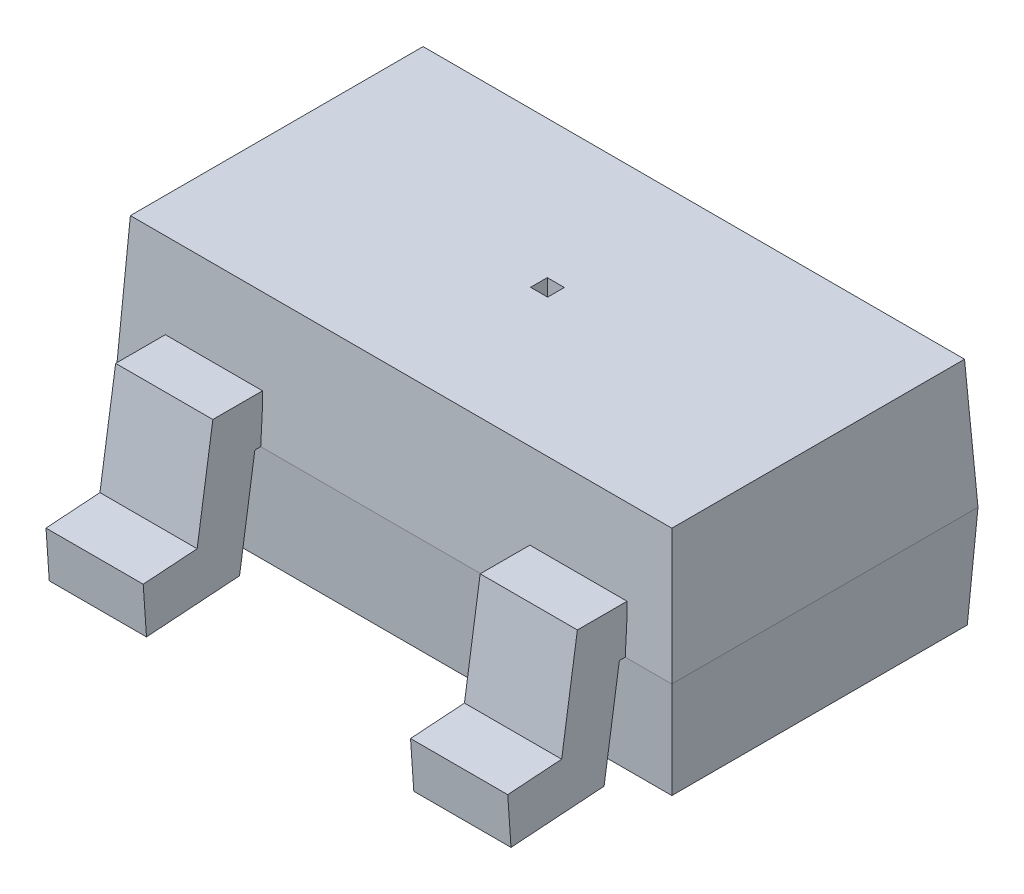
SolidWorks part; units mm, degrees
ref_plane "Front" through (0, 0, 0) normal (0, 0, 1) x (1, 0, 0)
ref_plane "Top" through (0, 0, 0) normal (0, 1, 0) x (1, 0, 0)
ref_plane "Right" through (0, 0, 0) normal (1, 0, 0) x (0, 0, -1)
sketch "Sketch1" plane through (0, 0, 0) normal (0, 1, 0) x (1, 0, 0)
  line L0 (1.45, -0.8) -> (-1.45, 0.8) construction
  line L1 (-1.45, 0.8) -> (1.45, 0.8)
  line L2 (-1.45, 0.8) -> (-1.45, -0.8)
  line L3 (-1.45, -0.8) -> (1.45, -0.8)
  line L4 (1.45, 0.8) -> (1.45, -0.8)
  dimension "D1" = 2.9
  dimension "D2" = 1.6
extrude "Boss-Extrude1" add sketch "Sketch1" against normal blind 0.533 draft 3
sketch "Sketch5" plane through (0, 0, 0) normal (0, 1, 0) x (1, 0, 0)
  line L4 (-1.45, 0.8) -> (-1.45, -0.8)
  line L5 (-1.45, -0.8) -> (1.45, -0.8)
  line L6 (1.45, -0.8) -> (1.45, 0.8)
  line L7 (1.45, 0.8) -> (-1.45, 0.8)
  line L8 (-1.45, 0.8) -> (-1.45, -0.8)
  line L9 (-1.45, -0.8) -> (1.45, -0.8)
  line L10 (1.45, -0.8) -> (1.45, 0.8)
  line L11 (1.45, 0.8) -> (-1.45, 0.8)
  dimension "D1" = 0
extrude "Boss-Extrude4" add sketch "Sketch5" along normal blind 0.67 draft 3
sketch "Sketch6" plane through (0, 0, 0) normal (1, 0, 0) x (0, 0, -1)
  line L0 (0.7905, 0) -> (0.8307, 0)
  line L1 (0.8307, 0) -> (0.9106, -0.5292)
  line L2 (0.9106, -0.5292) -> (1.397, -0.5629)
  line L3 (0.7905, 0.248) -> (1.0502, 0.248)
  line L4 (1.0502, 0.248) -> (1.1323, -0.2959)
  line L5 (1.1323, -0.2959) -> (1.4141, -0.3154)
  line L6 (1.4141, -0.3154) -> (1.397, -0.5629)
  line L7 (0.7905, 0.248) -> (0.7905, 0)
  line L8 (0, 0) -> (0, 0.4994) construction
  line L9 (-0.7905, 0.248) -> (-0.7905, 0) construction
  line L10 (-1.4141, -0.3154) -> (-1.397, -0.5629) construction
  line L11 (-1.1323, -0.2959) -> (-1.4141, -0.3154) construction
  line L12 (-1.0502, 0.248) -> (-1.1323, -0.2959) construction
  line L13 (-0.7905, 0.248) -> (-1.0502, 0.248) construction
  line L14 (-0.9106, -0.5292) -> (-1.397, -0.5629) construction
  line L15 (-0.8307, 0) -> (-0.9106, -0.5292) construction
  line L16 (-0.7905, 0) -> (-0.8307, 0) construction
  dimension "D1" = 0.248
  dimension "D2" = 0.248
  dimension "D3" = 1.397
  dimension "D4" = 0.254
extrude "Boss-Extrude5" add sketch "Sketch6" along normal mid plane 0.508
sketch "Sketch7" plane through (0, 0, 0) normal (1, 0, 0) x (0, 0, -1)
  line L0 (-0.7905, 0.248) -> (-0.7905, 0) construction
  line L1 (-0.7905, 0.248) -> (-1.0502, 0.248) construction
  line L2 (-1.0502, 0.248) -> (-1.1323, -0.2959) construction
  line L3 (-0.7905, 0) -> (-0.8307, 0) construction
  line L4 (-0.8307, 0) -> (-0.9106, -0.5292) construction
  line L5 (-0.9106, -0.5292) -> (-1.397, -0.5629) construction
  line L6 (-1.4141, -0.3154) -> (-1.397, -0.5629) construction
  line L7 (-1.1323, -0.2959) -> (-1.4141, -0.3154) construction
  line L8 (-0.7905, 0.248) -> (-0.7905, 0)
  line L9 (-0.7905, 0.248) -> (-1.0502, 0.248)
  line L10 (-1.0502, 0.248) -> (-1.1323, -0.2959)
  line L11 (-0.7905, 0) -> (-0.8307, 0)
  line L12 (-0.8307, 0) -> (-0.9106, -0.5292)
  line L13 (-0.9106, -0.5292) -> (-1.397, -0.5629)
  line L14 (-1.4141, -0.3154) -> (-1.397, -0.5629)
  line L15 (-1.1323, -0.2959) -> (-1.4141, -0.3154)
extrude "Boss-Extrude6" add sketch "Sketch7" along normal blind 0.508 from offset 0.6985
sketch "Sketch8" plane through (0, 0, 0) normal (1, 0, 0) x (0, 0, -1)
  line L0 (-0.7905, 0) -> (-0.8307, 0) construction
  line L1 (-0.7905, 0.248) -> (-0.7905, 0) construction
  line L2 (-0.7905, 0.248) -> (-1.0502, 0.248) construction
  line L3 (-1.0502, 0.248) -> (-1.1323, -0.2959) construction
  line L4 (-1.1323, -0.2959) -> (-1.4141, -0.3154) construction
  line L5 (-1.4141, -0.3154) -> (-1.397, -0.5629) construction
  line L6 (-0.9106, -0.5292) -> (-1.397, -0.5629) construction
  line L7 (-0.8307, 0) -> (-0.9106, -0.5292) construction
  line L8 (-0.7905, 0) -> (-0.8307, 0)
  line L9 (-0.7905, 0.248) -> (-0.7905, 0)
  line L10 (-0.7905, 0.248) -> (-1.0502, 0.248)
  line L11 (-1.0502, 0.248) -> (-1.1323, -0.2959)
  line L12 (-1.1323, -0.2959) -> (-1.4141, -0.3154)
  line L13 (-1.4141, -0.3154) -> (-1.397, -0.5629)
  line L14 (-0.9106, -0.5292) -> (-1.397, -0.5629)
  line L15 (-0.8307, 0) -> (-0.9106, -0.5292)
extrude "Boss-Extrude7" add sketch "Sketch8" against normal blind 0.508 from offset 0.6985
sketch "Sketch9" plane through (0, 0.67, 0) normal (0, 1, 0) x (1, 0, 0)
  line L0 (0.0447, -0.0437) -> (-0.0447, 0.0437) construction
  line L1 (-0.0447, 0.0437) -> (0.0447, 0.0437)
  line L2 (-0.0447, 0.0437) -> (-0.0447, -0.0437)
  line L3 (-0.0447, -0.0437) -> (0.0447, -0.0437)
  line L4 (0.0447, 0.0437) -> (0.0447, -0.0437)
extrude "Cut-Extrude1" cut sketch "Sketch9" against normal blind 0.762
equation "\"Buoyancy\"=\"SW-Volume\"*(\"SW-Density\"-.037062)"
